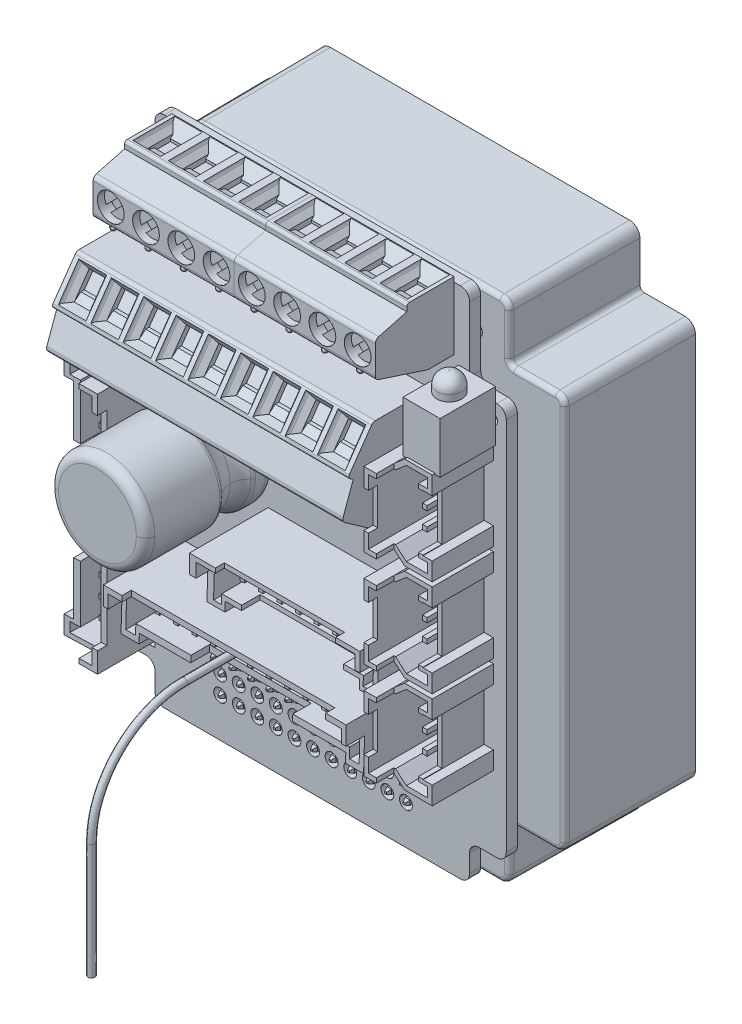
SolidWorks part; units mm, degrees
ref_plane "Front Plane" through (0, 0, 0) normal (0, 0, 1) x (1, 0, 0)
ref_plane "Top Plane" through (0, 0, 0) normal (0, 1, 0) x (1, 0, 0)
ref_plane "Right Plane" through (0, 0, 0) normal (1, 0, 0) x (0, 0, -1)
imported_body "Imported43"
imported_body "Imported44"
imported_body "Imported45"
imported_body "Imported46"
imported_body "Imported47"
imported_body "Imported48"
imported_body "Imported49"
imported_body "Imported50"
imported_body "Imported51"
imported_body "Imported52"
imported_body "Imported53"
imported_body "Imported54"
imported_body "Imported55"
imported_body "Imported56"
imported_body "Imported57"
imported_body "Imported58"
imported_body "Surface-Imported149"
imported_body "Surface-Imported150"
imported_body "Surface-Imported151"
imported_body "Surface-Imported152"
imported_body "Surface-Imported153"
imported_body "Surface-Imported154"
imported_body "Surface-Imported155"
imported_body "Surface-Imported156"
imported_body "Surface-Imported157"
imported_body "Surface-Imported158"
imported_body "Surface-Imported159"
imported_body "Surface-Imported160"
imported_body "Surface-Imported161"
imported_body "Surface-Imported162"
imported_body "Surface-Imported163"
imported_body "Surface-Imported164"
imported_body "Surface-Imported165"
imported_body "Surface-Imported166"
imported_body "Surface-Imported167"
imported_body "Surface-Imported168"
imported_body "Surface-Imported169"
imported_body "Surface-Imported170"
imported_body "Surface-Imported171"
imported_body "Surface-Imported172"
imported_body "Surface-Imported173"
imported_body "Surface-Imported174"
imported_body "Surface-Imported175"
imported_body "Surface-Imported176"
imported_body "Surface-Imported177"
imported_body "Surface-Imported178"
imported_body "Surface-Imported179"
imported_body "Surface-Imported180"
imported_body "Surface-Imported181"
imported_body "Surface-Imported182"
imported_body "Surface-Imported183"
imported_body "Surface-Imported184"
imported_body "Surface-Imported185"
imported_body "Surface-Imported186"
imported_body "Surface-Imported187"
imported_body "Surface-Imported188"
imported_body "Surface-Imported189"
imported_body "Surface-Imported190"
imported_body "Surface-Imported191"
imported_body "Surface-Imported192"
imported_body "Surface-Imported193"
imported_body "Surface-Imported194"
imported_body "Surface-Imported195"
sketch "Sketch1" plane through (0, 0, 26.5565) normal (0, 0, 1) x (1, 0, 0)
  circle A0 centre (15.0164, 61.6682) radius 0.9103
extrude "Boss-Extrude1" add sketch "Sketch1" along normal up to next
sketch "Sketch2" plane through (0, 0, 31.5565) normal (0, 0, 1) x (1, 0, 0)
  line L0 (26.108, 73.5032) -> (26.108, 73.2532) construction
  line L1 (25.858, 73.5032) -> (26.358, 73.5032) construction
  line L2 (26.358, 73.2532) -> (26.108, 73.2532) construction
  line L3 (26.358, 73.5032) -> (26.358, 73.0032) construction
  circle A0 centre (26.108, 73.2532) radius 0.381
  dimension "D1" = 0.762
ref_plane "Plane1" through (26.108, 0, 0) normal (1, 0, 0) x (0, 0, -1)
sketch "Sketch4" plane through (26.108, 0, 0) normal (1, 0, 0) x (0, 0, -1)
  line L0 (-31.5565, 73.2532) -> (-40.6565, 73.2532)
  line L1 (-50.6565, 63.2532) -> (-50.6565, 50.79)
  line L2 (-12.5565, 64.4471) -> (-12.5565, 105.2471) construction
  arc A0 (-40.6565, 73.2532) -> (-50.6565, 63.2532) centre (-40.6565, 63.2532) ccw
  dimension "D1" = 10
  dimension "D2" = 38.1
sweep "Sweep1" add profiles "Sketch2" path "Sketch4"
ref_plane "Plane2" through (29.9647, 0, 0) normal (-1, 0, 0) x (0, 0, 1)
